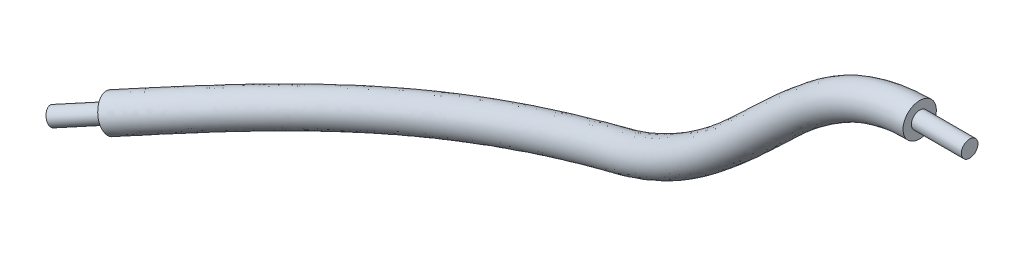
SolidWorks part; units mm, degrees
ref_plane "Plan de face" through (0, 0, 0) normal (0, 0, 1) x (1, 0, 0)
ref_plane "Plan de dessus" through (0, 0, 0) normal (0, 1, 0) x (1, 0, 0)
ref_plane "Plan de droite" through (0, 0, 0) normal (1, 0, 0) x (0, 0, -1)
sketch3d "Esquisse3D1"
  line L0 (-68.0939, -14.579, 28.8879) -> (-68.0939, -14.579, 28.0879) construction
  line L1 (-45.0939, -3.882, 36.6879) -> (-46.0939, -3.882, 36.6879) construction
  spline S0 degree 3 poles (-68.0939, -14.579, 37.9562) (-64.4237, -13.1021, 36.8191) (-60.7535, -11.6251, 35.682) (-49.5375, -7.6553, 37.1707) (-48.8654, -3.882, 36.6879) (-45.0939, -3.882, 36.6879) knots 0 0 0 0 0.585156 0.585156 1 1 1 1
ref_plane "Plan1" through (-45.0939, -3.882, 36.6879) normal (1, 0, 0) x (0, 0, -1)
sketch "Esquisse2" plane through (-45.0939, -3.882, 36.6879) normal (1, 0, 0) x (0, 0, -1)
  circle A0 centre (0, 0) radius 0.5
  dimension "D1" = 1
sweep "Balayage1" add profiles "Esquisse2" path "Esquisse3D1"
sketch "Esquisse3" plane through (-45.0939, 0, 0) normal (1, 0, 0) x (0, 0, -1)
  circle A3 centre (-36.6879, -3.882) radius 0.25
  circle A4 centre (-36.6879, -3.882) radius 0.25
  dimension "D1" = 0.25
extrude "Extrusion1" add sketch "Esquisse3" along normal blind 1.5
sketch "Esquisse4" plane through (-68.1437, -27.423, 21.1124) normal (-0.8916, -0.3588, 0.2762) x (0.2762, 0.0524, 0.9597)
  circle A2 centre (16.8511, 12.8345) radius 0.25
  circle A3 centre (16.8511, 12.8345) radius 0.25
  dimension "D1" = 0.25
extrude "Extrusion2" add sketch "Esquisse4" along normal blind 1.5
